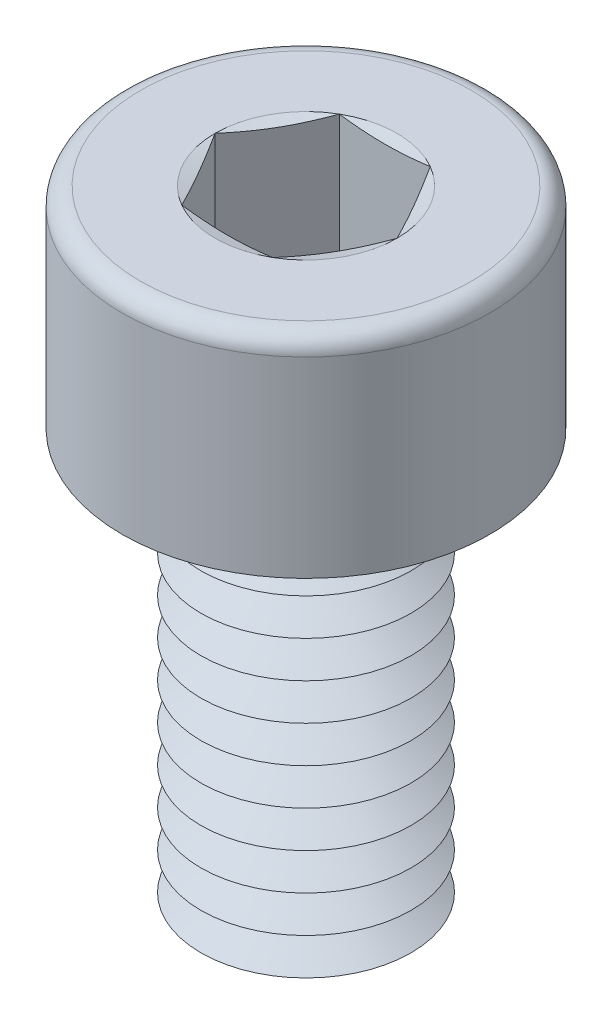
SolidWorks part; units mm, degrees
ref_plane "Front Plane" through (0, 0, 0) normal (0, 0, 1) x (1, 0, 0)
ref_plane "Top Plane" through (0, 0, 0) normal (0, 1, 0) x (1, 0, 0)
ref_plane "Right Plane" through (0, 0, 0) normal (1, 0, 0) x (0, 0, -1)
sketch "Sketch1" plane through (0, 0, 0) normal (0, 1, 0) x (1, 0, 0)
  circle A0 centre (0, 0) radius 2
  dimension "D1" = 4
extrude "Extrude1" add sketch "Sketch1" along normal blind 8
sketch "Sketch2" plane through (0, 8, 0) normal (0, 1, 0) x (1, 0, 0)
  circle A0 centre (0, 0) radius 3.5
  dimension "D1" = 7
extrude "Extrude2" add sketch "Sketch2" along normal blind 4
sketch "Sketch3" plane through (0, 12, 0) normal (0, 1, 0) x (1, 0, 0)
  line L1 (0.866, 1.5) -> (-0.866, 1.5)
  line L2 (-0.866, 1.5) -> (-1.7321, 0)
  line L3 (-1.7321, 0) -> (-0.866, -1.5)
  line L4 (-0.866, -1.5) -> (0.866, -1.5)
  line L5 (0.866, -1.5) -> (1.7321, 0)
  line L6 (1.7321, 0) -> (0.866, 1.5)
  circle A0 centre (0, 0) radius 1.5 construction
  dimension "D1" = 3
extrude "Extrude3" cut sketch "Sketch3" against normal blind 3
fillet "Fillet1" radius 0.35 1 edges at (0, 12, 3.5)
sketch "Sketch4" plane through (0, 0, 0) normal (1, 0, 0) x (0, 0, -1)
  line L0 (-1.5, 9) -> (0, 9)
  line L1 (0, 9) -> (0, 8.134)
  line L2 (0, 8.134) -> (-1.5, 9)
  dimension "D1" = 30
revolve "Cut-Revolve1" cut sketch "Sketch4" angle 360 about L1
sketch "Sketch5" plane through (0, 0, 0) normal (0, 0, 1) x (1, 0, 0)
  line L0 (-2, 0.35) -> (-2, -0.35)
  line L1 (-2, 8) -> (-2, 0) construction
  line L2 (-2, -0.35) -> (-1.3938, 0)
  line L3 (-2, 0) -> (2, 0) construction
  line L4 (-1.3938, 0) -> (-2, 0.35)
  dimension "D1" = 0.7
revolve "Cut-Revolve2" cut sketch "Sketch5" angle 360 about axis through (0, 8, 0) along (0, -1, 0)
pattern_linear "LPattern1" count 11 spacing 0.7 along (0, 1, 0) of "Cut-Revolve2"
sketch "Sketch6" plane through (0, 12, 0) normal (0, 1, 0) x (1, 0, 0)
  circle A0 centre (0, 0) radius 1.7321
extrude "Extrude4" cut sketch "Sketch6" against normal through all draft 75
